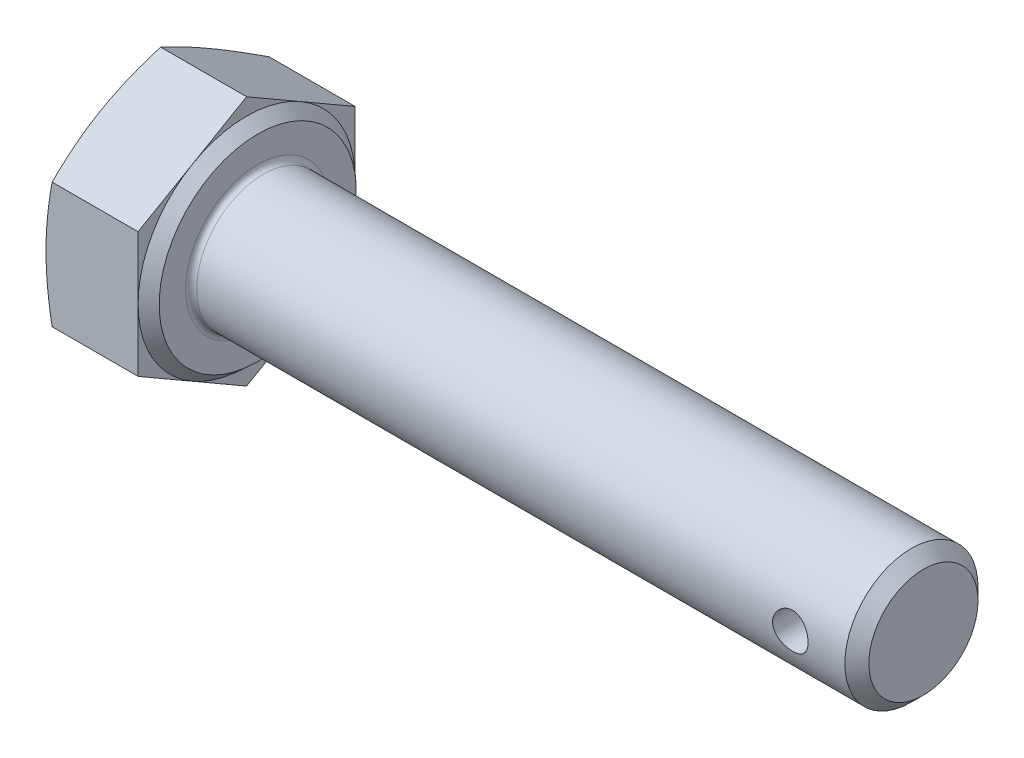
SolidWorks part; units mm, degrees
ref_plane "Front" through (0, 0, 0) normal (0, 0, 1) x (1, 0, 0)
ref_plane "Top" through (0, 0, 0) normal (0, 1, 0) x (1, 0, 0)
ref_plane "Right" through (0, 0, 0) normal (1, 0, 0) x (0, 0, -1)
sketch "Sketch-BaseHead" plane through (0, 0, 0) normal (1, 0, 0) x (0, 0, -1)
  line L1 (0, -5.6465) -> (4.89, -2.8232)
  line L2 (4.89, -2.8232) -> (4.89, 2.8232)
  line L3 (4.89, 2.8232) -> (0, 5.6465)
  line L4 (0, 5.6465) -> (-4.89, 2.8232)
  line L5 (-4.89, 2.8232) -> (-4.89, -2.8232)
  line L6 (-4.89, -2.8232) -> (0, -5.6465)
  circle A0 centre (0, 0) radius 4.89 construction
  dimension "s" = 9.78
extrude "BaseHead" add sketch "Sketch-BaseHead" along normal blind 4.15
sketch "Sketch4" plane through (-0.2646, -5.9169, 0) normal (0, 0, 1) x (0, 1, 0)
  line L0 (5.9169, 3.7369) -> (5.9169, -10.4477) construction
  line L2 (11.5634, -0.2646) -> (10.8069, -0.2646)
  line L4 (10.8069, -0.2646) -> (11.5634, -0.54)
  line L6 (11.5634, -0.54) -> (11.5634, -0.2646)
  dimension "D1" = 20
  dimension "D2" = 9.78
revolve "HeadChamfer" cut sketch "Sketch4" angle 360 about L0
sketch "Sketch1" plane through (0, 0, 0) normal (0, 1, 0) x (1, 0, 0)
  line L0 (4.15, 0) -> (4.65, 0)
  line L1 (4.65, 0) -> (4.65, 4.44)
  line L2 (4.65, 4.44) -> (4.15, 4.89)
  line L3 (4.15, 4.89) -> (4.15, 0)
  line L6 (-4.0016, 0) -> (10.1831, 0) construction
  dimension "D1" = 4.89
  dimension "D2" = 4.44
  dimension "D3" = 0.5
revolve "Revolve1" add sketch "Sketch1" angle 360 about axis through (-4.0016, 0, 0) along (1, 0, 0)
ref_plane "Plane2" through (16.65, 0, 0) normal (1, 0, 0) x (0, 0, -1)
sketch "Sketch3" plane through (4.65, 0, 0) normal (1, 0, 0) x (0, 0, -1)
  circle A0 centre (0, 0) radius 3
  dimension "d" = 6
extrude "BaseBody" add sketch "Sketch3" along normal blind 30
chamfer "Chamfer1" distance 0.5415 angle 45 1 edges at (34.65, 3, 0)
fillet "HeadFillet" radius 0.25 1 edges at (4.65, -3, 0)
sketch "Sketch5" plane through (0, 0, 0) normal (0, 0, 1) x (1, 0, 0)
  line L2 (4.65, -4.44) -> (4.65, 4.44) construction
  line L3 (34.1085, 0) -> (4.9, 0) construction
  circle A0 centre (31.65, 0) radius 0.8
  dimension "d1" = 1.6
  dimension "lh" = 27
extrude "Hole" cut sketch "Sketch5" against normal through all and the other way through all
equation "\"D1@Sketch1\" = \"s@Sketch-BaseHead\" / 2"
equation "\"D2@Sketch4\" = \"s@Sketch-BaseHead\""
equation "\"D1@Chamfer1\" = (  \"d@Sketch3\"  -\"D2@ThreadCosmetic1\" ) / 2 "
equation "\"b@ThreadCosmetic1\" = \"l@BaseBody\" - \"lg@Plane2\""
